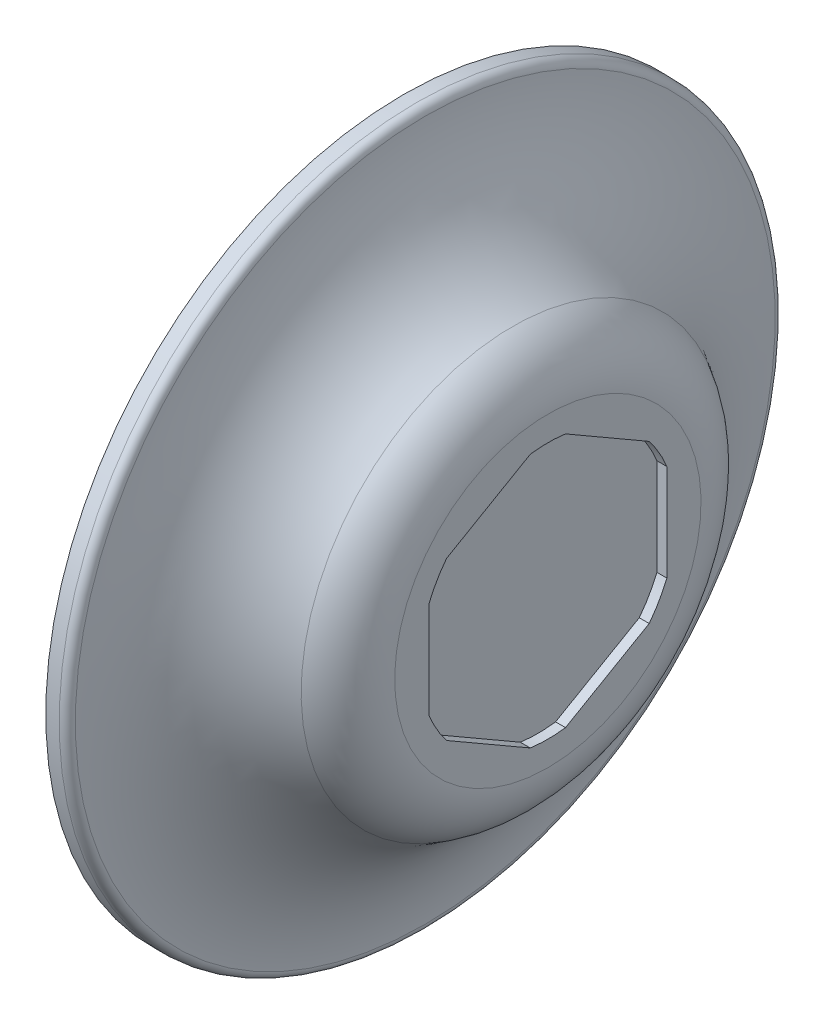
SolidWorks part; units mm, degrees
ref_plane "Front" through (0, 0, 0) normal (0, 0, 1) x (1, 0, 0)
ref_plane "Right" through (0, 0, 0) normal (0, 1, 0) x (1, 0, 0)
ref_plane "Top" through (0, 0, 0) normal (1, 0, 0) x (0, 0, -1)
sketch "Sketch1" plane through (0, 0, 0) normal (0, 0, 1) x (1, 0, 0)
  line L0 (6.9494, 0) -> (16.0499, 0) construction
  line L1 (6.9494, 0) -> (9.4132, 0)
  line L2 (9.4132, 0) -> (9.4132, 11.7436)
  line L3 (6.9494, 0) -> (6.9494, 15.598)
  line L4 (0, 27.432) -> (-1.651, 27.432)
  line L5 (-1.651, 27.432) -> (-1.651, 26.162)
  line L6 (-1.651, 26.162) -> (-0.3958, 26.162)
  arc A0 (9.4132, 11.7436) -> (6.7237, 16.226) centre (4.3332, 11.7436) ccw
  arc A1 (6.7237, 16.226) -> (0, 27.432) centre (12.7, 27.432) cw
  arc A3 (-0.3958, 26.162) -> (6.9494, 15.598) centre (12.7, 27.432) ccw
  dimension "D2" = 12.7
  dimension "D3" = 13.1572
  dimension "D8" = 5.08
  dimension "D1" = 27.432
  dimension "D4" = 1.651
  dimension "D5" = 1.27
  dimension "D6" = 2.4638
  dimension "D7" = 11.0642
revolve "Main Body" add sketch "Sketch1" angle 360 about L0
sketch "Sketch2" plane through (9.4132, 0, 0) normal (1, 0, 0) x (0, 0, -1)
  circle A0 centre (0, 0) radius 3.3655
  circle A1 centre (0, 0) radius 11.7436 construction
  dimension "D1" = 6.731
extrude "Center Hole" cut sketch "Sketch2" against normal through all
sketch "Sketch3" plane through (9.4132, 0, 0) normal (1, 0, 0) x (0, 0, -1)
  line L0 (-9.1186, 3.7049) -> (-9.1186, -3.7049)
  line L1 (0, 0) -> (0, 7.0824) construction
  line L2 (9.1186, 3.7049) -> (9.1186, -3.7049)
  line L3 (1.3508, -9.7494) -> (7.7678, -6.0445)
  line L4 (0, 0) -> (-5.7302, -3.3083) construction
  line L5 (1.3508, 9.7494) -> (7.7678, 6.0445)
  line L6 (0, 0) -> (5.099, -2.9439) construction
  line L7 (-7.7678, -6.0445) -> (-1.3508, -9.7494)
  line L8 (0, 0) -> (7.3956, 0) construction
  line L10 (-7.7678, 6.0445) -> (-1.3508, 9.7494)
  arc A0 (1.3508, 9.7494) -> (-1.3508, 9.7494) centre (0, 0) ccw
  arc A1 (9.1186, 3.7049) -> (7.7678, 6.0445) centre (0, 0) ccw
  arc A2 (7.7678, -6.0445) -> (9.1186, -3.7049) centre (0, 0) ccw
  arc A3 (-1.3508, -9.7494) -> (1.3508, -9.7494) centre (0, 0) ccw
  arc A4 (-9.1186, -3.7049) -> (-7.7678, -6.0445) centre (0, 0) ccw
  arc A5 (-7.7678, 6.0445) -> (-9.1186, 3.7049) centre (0, 0) ccw
  circle A6 centre (0, 0) radius 27.432 construction
  dimension "D1" = 19.685
  dimension "D2" = 18.2372
  dimension "D5" = 120
  dimension "D6" = 120
extrude "Hex" cut sketch "Sketch3" against normal blind 0.762
sketch "Sketch4" plane through (6.9494, 0, 0) normal (-1, 0, 0) x (0, 0, 1)
  circle A0 centre (0, 0) radius 12.2555
  circle A1 centre (0, 0) radius 15.598 construction
  dimension "D1" = 24.511
extrude "Back Recess" cut sketch "Sketch4" against normal blind 0.7493
fillet "Fillet1" radius 0.635 1 edges at (0, -27.432, 0)
